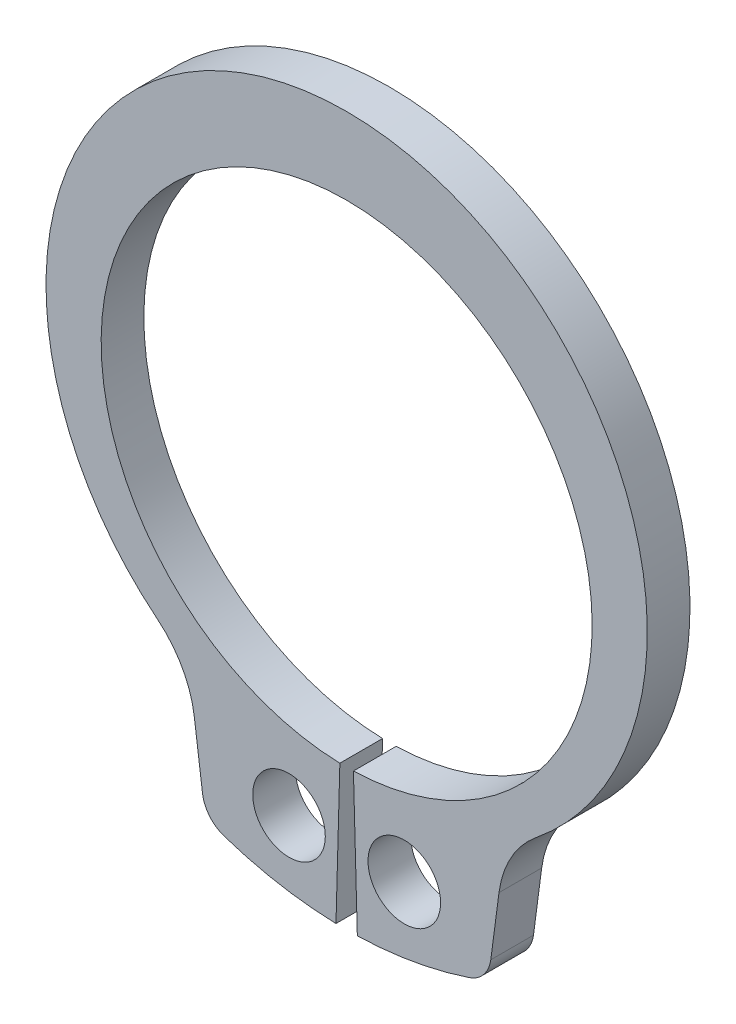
SolidWorks part; units mm, degrees
ref_plane "Plane1" through (0, 0, 0) normal (0, 0, 1) x (1, 0, 0)
ref_plane "Plane2" through (0, 0, 0) normal (0, 1, 0) x (1, 0, 0)
ref_plane "Plane3" through (0, 0, 0) normal (1, 0, 0) x (0, 0, -1)
extrude "Body" add sketch "BodySke" against normal blind 1
sketch "BodySke" plane through (0, 0, 0) normal (0, 0, 1) x (1, 0, 0)
  line L0 (-1.5431, 0) -> (1.5431, 0) construction
  line L1 (0, 0) -> (0, 7.55) construction
  line L2 (0.1588, -5.7478) -> (0.25, -9.0465)
  line L3 (-0.1588, -5.7478) -> (-0.25, -9.0465)
  line L4 (0, 0) -> (5.9454, -6.8231) construction
  line L5 (0, 0) -> (-5.9454, -6.8231) construction
  line L7 (3.5679, -6.5101) -> (3.3758, -7.9695)
  line L8 (-3.5679, -6.5101) -> (-3.3758, -7.9695)
  circle A0 centre (0, 0) radius 5.75 construction
  arc A1 (0.1588, -5.7478) -> (-0.1588, -5.7478) centre (0, 0) ccw
  arc A2 (4.3687, -5.0137) -> (-4.3687, -5.0137) centre (0, 0.5086) ccw construction
  arc A3 (0.25, -9.0465) -> (2.8701, -8.5828) centre (0, 0) ccw
  arc A4 (4.435, -4.9605) -> (3.5679, -6.5101) centre (5.9454, -6.8231) ccw
  arc A5 (-3.5679, -6.5101) -> (-4.435, -4.9605) centre (-5.9454, -6.8231) ccw
  arc A6 (-2.8701, -8.5828) -> (-0.25, -9.0465) centre (0, 0) ccw
  arc A7 (4.435, -4.9605) -> (-4.435, -4.9605) centre (0, 0.5086) ccw
  arc A8 (-3.5516, -6.6341) -> (3.5516, -6.6341) centre (0, 0) ccw construction
  circle A9 centre (1.35, -7.4029) radius 0.85
  circle A10 centre (-1.35, -7.4029) radius 0.85
  arc A11 (3.3758, -7.9695) -> (2.8701, -8.5828) centre (2.6322, -7.8716) cw
  arc A12 (-3.3758, -7.9695) -> (-2.8701, -8.5828) centre (-2.6322, -7.8716) ccw
  point P28 (3.3164, -8.4204)
  point P31 (-3.3164, -8.4204)
  dimension "GrooveDia" = 11.5
  dimension "D3" = 0.75
  dimension "LugRad" = 9.05
  dimension "HoleOffsetRad" = 7.525
  dimension "HoleDia" = 1.7
  dimension "D2" = 15
  dimension "LargeRad" = 7.55
  dimension "SmallRad" = 6.65
  dimension "Gap" = 0.5
  dimension "SmallAngle" = 82.135
  dimension "HoleSpacing" = 2.7
sketch "Clipboard" plane through (0, 0, 0) normal (0, 0, 1) x (1, 0, 0)
  line L0 (0, 0) -> (1.8, 0)
  line L1 (0, 0) -> (0, 0.9)
  line L2 (0, 0) -> (0, -3.3)
  circle A0 centre (0, 0) radius 0.85
  circle A1 centre (0, 0) radius 6
  dimension "HoleDia" = 1.7
  dimension "ShaftDia" = 12
  dimension "LargeSection" = 1.8
  dimension "SmallSection" = 0.9
  dimension "LugSection" = 3.3
sketch "NotSke" plane through (0, 0, 0) normal (0, 0, 1) x (1, 0, 0)
  line L0 (1.35, -6.5529) -> (1.35, -8.2529)
  line L1 (1.35, -8.2529) -> (-1.35, -8.2529)
  line L2 (-1.35, -8.2529) -> (-1.35, -6.5529)
  line L3 (-1.35, -6.5529) -> (1.35, -6.5529)
  circle A0 centre (1.35, -7.4029) radius 0.85 construction
  circle A1 centre (-1.35, -7.4029) radius 0.85 construction
extrude "Notch" cut sketch "NotSke" against normal through all
sketch "UnlSke" plane through (0, 0, 0) normal (0, 0, 1) x (1, 0, 0)
  line L0 (-2.6189, -8.6628) -> (-1.6639, -5.504)
  line L1 (2.6189, -8.6628) -> (1.6639, -5.504)
  arc A0 (1.6639, -5.504) -> (-1.6639, -5.504) centre (0, 0) ccw
  arc A1 (2.6189, -8.6628) -> (-2.6189, -8.6628) centre (0, 0) ccw
  arc A2 (0.25, -9.0465) -> (2.8701, -8.5828) centre (0, 0) ccw construction
  arc A3 (0.1588, -5.7478) -> (-0.1588, -5.7478) centre (0, 0) ccw construction
  circle A4 centre (-1.35, -7.4029) radius 0.85 construction
  circle A5 centre (1.35, -7.4029) radius 0.85 construction
extrude "Unlug" add sketch "UnlSke" against normal through all
equation "' \"ShaftDia@Clipboard\" = 3"
equation "' \"Thickness@Body\" = 0.4"
equation "' \"GrooveDia@BodySke\" = 2.8"
equation "' \"LugSection@Clipboard\" = 1.9"
equation "' \"LargeSection@Clipboard\" = 0.8"
equation "' \"HoleDia@Clipboard\" = 1.0"
equation "' \"ShaftDia@Clipboard\" = 10"
equation "' \"Thickness@Body\" = 1.0"
equation "' \"GrooveDia@BodySke\" = 9.6"
equation "' \"LugSection@Clipboard\" = 3.3"
equation "' \"LargeSection@Clipboard\" = 1.8"
equation "' \"HoleDia@Clipboard\" = 1.5"
equation "\"SmallSection@Clipboard\" = \"LargeSection@Clipboard\" * 0.5"
equation "\"Gap@BodySke\" =  \"Thickness@Body\" / 2"
equation "\"LargeRad@BodySke\" =  \"GrooveDia@BodySke\" / 2 +  \"LargeSection@Clipboard\""
equation "\"SmallRad@BodySke\" =  \"GrooveDia@BodySke\" / 2 +  \"SmallSection@Clipboard\""
equation "\"LugRad@BodySke\" = \"GrooveDia@BodySke\" / 2 + \"LugSection@Clipboard\""
equation "\"HoleOffsetRad@BodySke\" = (  \"ShaftDia@Clipboard\" / 2 + \"LugRad@BodySke\" ) / 2"
equation "\"HoleSpacing@BodySke\" = \"Gap@BodySke\"  * 2 +  \"HoleDia@Clipboard\""
equation "\"HoleDia@BodySke\" =  \"HoleDia@Clipboard\""
equation "\"SmallAngle@BodySke\" = atn(\"HoleSpacing@BodySke\" / 2 / sqr(\"HoleOffsetRad@BodySke\"  * \"HoleOffsetRad@BodySke\" - (\"HoleSpacing@BodySke\" / 2) * (\"HoleSpacing@BodySke\" / 2) ))  * 7 *  (\"LargeRad@BodySke\""
